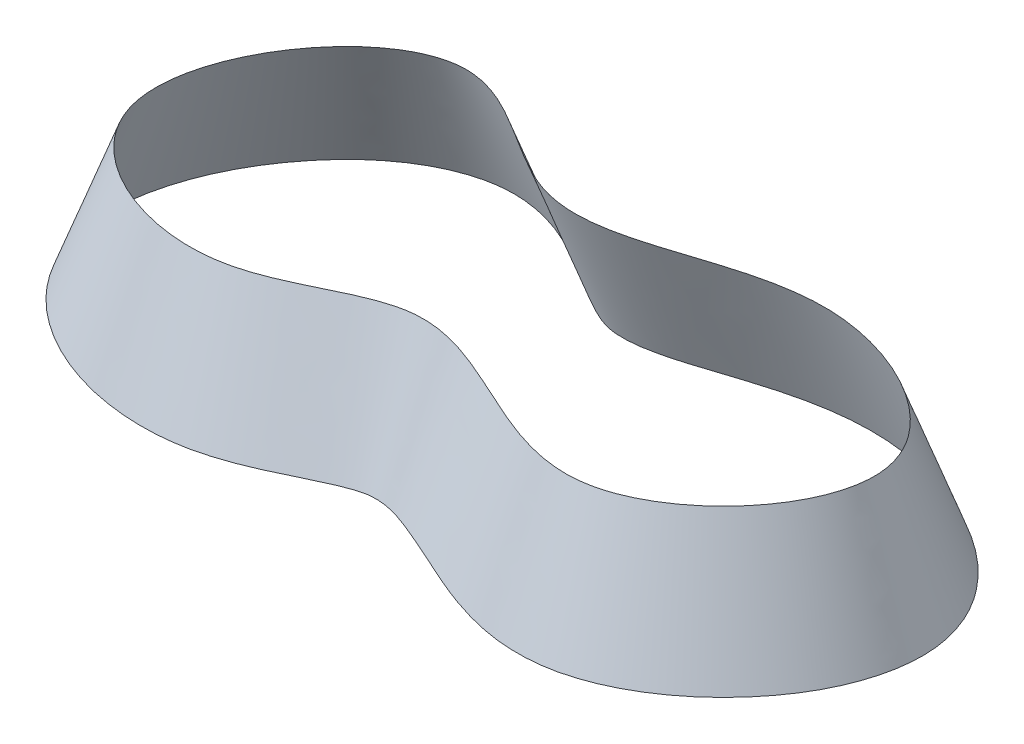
SolidWorks part; units mm, degrees
ref_plane "Front XY" through (0, 0, 0) normal (0, 0, 1) x (1, 0, 0)
ref_plane "Top XZ" through (0, 0, 0) normal (0, 1, 0) x (1, 0, 0)
ref_plane "Right YZ" through (0, 0, 0) normal (1, 0, 0) x (0, 0, -1)
sketch "Sketch1" plane through (0, 0, 0) normal (0, 1, 0) x (1, 0, 0)
  spline S0 degree 3 poles (39.677, -36.9078) (4.017, -0.3298) (-26.5781, -27.4979) (-74.8669, -7.0946) (-37.7696, 46.4378) (-3.0666, 8.7856) (31.545, 37.6168) (81.1209, 9.9494) (39.677, -36.9078) (4.017, -0.3298) (-26.5781, -27.4979) knots -0.392306 -0.273603 -0.1444 0 0.092111 0.21453 0.359628 0.455139 0.607694 0.726397 0.8556 1 1.092111 1.21453 1.359628 only from (0, -10.5909) to (0, -10.5909)
surface "Surface-Plane1" sketch "Sketch1"
other "Ruled Surface1" parameters "D1"=25.4, "D2"=20
sketch3d "3DSketch1"
  spline S0 degree 1 poles (-54.9928, 1879.3755, -671.2317) (55.6909, -1903.2331, 701.0689) knots -78.739749 -78.739749 79.739308 79.739308 only from (0, 0, 10.5909) to (0.6984, -23.8682, 19.2501) construction
  spline S1 degree 1 poles (0, 0, 10.5909) (0.6984, -23.8682, 19.2501) knots 0 0 1 1
sketch3d "3DSketch2"
  spline S0 degree 1 poles (125.1056, 1879.9208, -661.0015) (-115.7, -1903.7816, 691.4528) knots -78.762595 -78.762595 79.762286 79.762286 only from (5.4621, 0, 10.9612) to (3.943, -23.8682, 19.4927) construction
  spline S1 degree 1 poles (5.4621, 0, 10.9612) (3.943, -23.8682, 19.4927) knots 0 0 1 1
sketch3d "3DSketch3"
  spline S0 degree 1 poles (252.5689, 1879.1403, -628.0759) (-233.5531, -1903.0009, 661.4129) knots -78.729896 -78.729896 79.729578 79.729578 only from (11.0413, 0, 12.601) to (7.9735, -23.8682, 20.7386) construction
  spline S1 degree 1 poles (11.0413, 0, 12.601) (7.9735, -23.8682, 20.7386) knots 0 0 1 1
sketch3d "3DSketch4"
  spline S0 degree 1 poles (302.5055, 1878.9179, -607.8788) (-272.6737, -1902.7763, 645.7811) knots -78.720576 -78.720576 79.720166 79.720166 only from (16.7303, 0, 14.9965) to (13.1, -23.8682, 22.909) construction
  spline S1 degree 1 poles (16.7303, 0, 14.9965) (13.1, -23.8682, 22.909) knots 0 0 1 1
sketch3d "3DSketch5"
  spline S0 degree 1 poles (298.5985, 1879.4447, -608.0049) (-257.0595, -1903.3015, 651.2153) knots -78.74265 -78.74265 79.742172 79.742172 only from (22.5217, 0, 17.6344) to (19.0156, -23.8682, 25.5798) construction
  spline S1 degree 1 poles (22.5217, 0, 17.6344) (19.0156, -23.8682, 25.5798) knots 0 0 1 1
sketch3d "3DSketch6"
  spline S0 degree 1 poles (252.1261, 1879.3837, -626.3932) (-198.1498, -1903.2412, 674.6006) knots -78.740092 -78.740092 79.739647 79.739647 only from (28.4081, 0, 20.0009) to (25.5669, -23.8682, 28.2101) construction
  spline S1 degree 1 poles (28.4081, 0, 20.0009) (25.5669, -23.8682, 28.2101) knots 0 0 1 1
sketch3d "3DSketch7"
  spline S0 degree 1 poles (149.2336, 1879.2645, -653.057) (-81.9272, -1903.1235, 704.7873) knots -78.735097 -78.735097 79.734714 79.734714 only from (34.3823, 0, 21.5826) to (32.9235, -23.8682, 30.151) construction
  spline S1 degree 1 poles (34.3823, 0, 21.5826) (32.9235, -23.8682, 30.151) knots 0 0 1 1
sketch3d "3DSketch8"
  spline S0 degree 1 poles (-22.0093, 1879.5172, -658.9259) (103.6755, -1903.3781, 711.3001) knots -78.745688 -78.745688 79.745381 79.745381 only from (40.4367, 0, 21.8657) to (41.2297, -23.8682, 30.5112) construction
  spline S1 degree 1 poles (40.4367, 0, 21.8657) (41.2297, -23.8682, 30.5112) knots 0 0 1 1
sketch3d "3DSketch9"
  spline S0 degree 1 poles (-195.0888, 1879.2997, -619.7593) (291.2296, -1903.1583, 668.7005) knots -78.736573 -78.736573 79.736172 79.736172 only from (46.5366, 0, 20.4069) to (49.6054, -23.8682, 28.5374) construction
  spline S1 degree 1 poles (46.5366, 0, 20.4069) (49.6054, -23.8682, 28.5374) knots 0 0 1 1
sketch3d "3DSketch10"
  spline S0 degree 1 poles (-327.7998, 1879.3448, -551.41) (437.4878, -1903.2028, 593.2619) knots -78.738462 -78.738462 79.738036 79.738036 only from (52.4305, 0, 17.316) to (57.2595, -23.8682, 24.539) construction
  spline S1 degree 1 poles (52.4305, 0, 17.316) (57.2595, -23.8682, 24.539) knots 0 0 1 1
sketch3d "3DSketch11"
  spline S0 degree 1 poles (-422.8613, 1879.3579, -473.8347) (544.4908, -1903.2158, 505.944) knots -78.739011 -78.739011 79.738579 79.738579 only from (57.764, 0, 12.9647) to (63.8681, -23.8682, 19.1472) construction
  spline S1 degree 1 poles (57.764, 0, 12.9647) (63.8681, -23.8682, 19.1472) knots 0 0 1 1
sketch3d "3DSketch12"
  spline S0 degree 1 poles (-500.2545, 1879.0813, -383.0317) (631.7613, -1902.9427, 403.4469) knots -78.727424 -78.727424 79.727137 79.727137 only from (62.1823, 0, 7.7266) to (69.3264, -23.8682, 12.69) construction
  spline S1 degree 1 poles (62.1823, 0, 7.7266) (69.3264, -23.8682, 12.69) knots 0 0 1 1
sketch3d "3DSketch13"
  spline S0 degree 1 poles (-568.1714, 1879.33, -256.396) (706.8749, -1903.1882, 263.6261) knots -78.737844 -78.737844 79.737426 79.737426 only from (65.3306, 0, 1.975) to (73.3763, -23.8682, 5.2564) construction
  spline S1 degree 1 poles (65.3306, 0, 1.975) (73.3763, -23.8682, 5.2564) knots 0 0 1 1
sketch3d "3DSketch14"
  spline S0 degree 1 poles (-614.2599, 1879.4066, -66.1455) (756.6136, -1903.2639, 59.1024) knots -78.741054 -78.741054 79.740596 79.740596 only from (66.8538, 0, -3.9165) to (75.5038, -23.8682, -3.1262) construction
  spline S1 degree 1 poles (66.8538, 0, -3.9165) (75.5038, -23.8682, -3.1262) knots 0 0 1 1
sketch3d "3DSketch15"
  spline S0 degree 1 poles (-592.2725, 1879.5635, 173.0423) (733.4369, -1903.4238, -194.5123) knots -78.747628 -78.747628 79.747296 79.747296 only from (66.4014, 0, -9.5759) to (74.7658, -23.8682, -11.8949) construction
  spline S1 degree 1 poles (66.4014, 0, -9.5759) (74.7658, -23.8682, -11.8949) knots 0 0 1 1
sketch3d "3DSketch16"
  spline S0 degree 1 poles (-495.1514, 1879.3304, 379.6662) (630.0528, -1903.1886, -414.105) knots -78.737861 -78.737861 79.737443 79.737443 only from (63.9021, 0, -14.716) to (71.0023, -23.8682, -19.7248) construction
  spline S1 degree 1 poles (63.9021, 0, -14.716) (71.0023, -23.8682, -19.7248) knots 0 0 1 1
sketch3d "3DSketch17"
  spline S0 degree 1 poles (-380.7474, 1879.3652, 504.1891) (505.806, -1903.223, -549.206) knots -78.73932 -78.73932 79.738884 79.738884 only from (59.7334, 0, -19.1864) to (65.3276, -23.8682, -25.8334) construction
  spline S1 degree 1 poles (59.7334, 0, -19.1864) (65.3276, -23.8682, -25.8334) knots 0 0 1 1
sketch3d "3DSketch18"
  spline S0 degree 1 poles (-272.9752, 1879.2591, 578.1767) (385.7574, -1903.1183, -631.5057) knots -78.734874 -78.734874 79.734494 79.734494 only from (54.3135, 0, -22.8492) to (58.4703, -23.8682, -30.4827) construction
  spline S1 degree 1 poles (54.3135, 0, -22.8492) (58.4703, -23.8682, -30.4827) knots 0 0 1 1
sketch3d "3DSketch19"
  spline S0 degree 1 poles (-170.6799, 1879.3071, 622.7548) (269.5778, -1903.1656, -682.1178) knots -78.736882 -78.736882 79.736477 79.736477 only from (48.0604, 0, -25.5662) to (50.8386, -23.8682, -33.8002) construction
  spline S1 degree 1 poles (48.0604, 0, -25.5662) (50.8386, -23.8682, -33.8002) knots 0 0 1 1
sketch3d "3DSketch20"
  spline S0 degree 1 poles (-58.9708, 1879.6131, 648.7727) (143.0295, -1903.4728, -711.7523) knots -78.749705 -78.749705 79.749347 79.749347 only from (41.3924, 0, -27.1994) to (42.6668, -23.8682, -35.7832) construction
  spline S1 degree 1 poles (41.3924, 0, -27.1994) (42.6668, -23.8682, -35.7832) knots 0 0 1 1
sketch3d "3DSketch21"
  spline S0 degree 1 poles (50.0072, 1879.2149, 656.6983) (19.2451, -1903.0746, -720.6184) knots -78.73302 -78.73302 79.732663 79.732663 only from (34.7232, 0, -27.6158) to (34.5291, -23.8682, -36.3074) construction
  spline S1 degree 1 poles (34.7232, 0, -27.6158) (34.5291, -23.8682, -36.3074) knots 0 0 1 1
sketch3d "3DSketch22"
  spline S0 degree 1 poles (139.3147, 1878.8994, 649.4038) (-84.1506, -1902.7581, -711.7856) knots -78.719803 -78.719803 79.719403 79.719403 only from (28.287, 0, -26.897) to (26.8765, -23.8682, -35.4883) construction
  spline S1 degree 1 poles (28.287, 0, -26.897) (26.8765, -23.8682, -35.4883) knots 0 0 1 1
sketch3d "3DSketch23"
  spline S0 degree 1 poles (200.0751, 1878.8281, 636.6256) (-158.1864, -1902.6877, -695.8628) knots -78.716816 -78.716816 79.716454 79.716454 only from (22.0746, 0, -25.4149) to (19.8133, -23.8682, -33.8254) construction
  spline S1 degree 1 poles (22.0746, 0, -25.4149) (19.8133, -23.8682, -33.8254) knots 0 0 1 1
sketch3d "3DSketch24"
  spline S0 degree 1 poles (223.9893, 1879.2042, 628.6068) (-194.5102, -1903.064, -684.0114) knots -78.732574 -78.732574 79.732222 79.732222 only from (16.0596, 0, -23.5621) to (13.4186, -23.8682, -31.8454) construction
  spline S1 degree 1 poles (16.0596, 0, -23.5621) (13.4186, -23.8682, -31.8454) knots 0 0 1 1
sketch3d "3DSketch25"
  spline S0 degree 1 poles (202.899, 1879.3907, 634.5628) (-184.9137, -1903.2481, -686.3558) knots -78.740384 -78.740384 79.739935 79.739935 only from (10.2156, 0, -21.7309) to (7.7686, -23.8682, -30.0658) construction
  spline S1 degree 1 poles (10.2156, 0, -21.7309) (7.7686, -23.8682, -30.0658) knots 0 0 1 1
sketch3d "3DSketch26"
  spline S0 degree 1 poles (132.8559, 1879.4017, 651.5007) (-125.4523, -1903.259, -700.6566) knots -78.740848 -78.740848 79.740392 79.740392 only from (4.5163, 0, -20.3139) to (2.8864, -23.8682, -28.8459) construction
  spline S1 degree 1 poles (4.5163, 0, -20.3139) (2.8864, -23.8682, -28.8459) knots 0 0 1 1
sketch3d "3DSketch27"
  spline S0 degree 1 poles (9.1811, 1879.2284, 664.6664) (-11.4406, -1903.0879, -712.7626) knots -78.733587 -78.733587 79.733223 79.733223 only from (-1.0647, 0, -19.7036) to (-1.1948, -23.8682, -28.3958) construction
  spline S1 degree 1 poles (-1.0647, 0, -19.7036) (-1.1948, -23.8682, -28.3958) knots 0 0 1 1
sketch3d "3DSketch28"
  spline S0 degree 1 poles (-170.6524, 1879.5844, 643.1774) (159.6276, -1903.4445, -692.1845) knots -78.748503 -78.748503 79.748161 79.748161 only from (-6.5539, 0, -20.2924) to (-4.4701, -23.8682, -28.7176) construction
  spline S1 degree 1 poles (-6.5539, 0, -20.2924) (-4.4701, -23.8682, -28.7176) knots 0 0 1 1
sketch3d "3DSketch29"
  spline S0 degree 1 poles (-318.8223, 1879.2825, 589.2619) (298.7604, -1903.1413, -641.7917) knots -78.735852 -78.735852 79.73546 79.73546 only from (-11.9787, 0, -22.3823) to (-8.0816, -23.8682, -30.1506) construction
  spline S1 degree 1 poles (-11.9787, 0, -22.3823) (-8.0816, -23.8682, -30.1506) knots 0 0 1 1
sketch3d "3DSketch30"
  spline S0 degree 1 poles (-379.8106, 1879.3202, 554.8044) (349.6599, -1903.1785, -613.18) knots -78.737432 -78.737432 79.737019 79.737019 only from (-17.3759, 0, -25.5042) to (-12.7729, -23.8682, -32.8744) construction
  spline S1 degree 1 poles (-17.3759, 0, -25.5042) (-12.7729, -23.8682, -32.8744) knots 0 0 1 1
sketch3d "3DSketch31"
  spline S0 degree 1 poles (-361.047, 1879.3177, 565.9331) (319.7675, -1903.1761, -631.0834) knots -78.737329 -78.737329 79.736918 79.736918 only from (-22.7869, 0, -28.8) to (-18.4909, -23.8682, -36.3534) construction
  spline S1 degree 1 poles (-22.7869, 0, -28.8) (-18.4909, -23.8682, -36.3534) knots 0 0 1 1
sketch3d "3DSketch32"
  spline S0 degree 1 poles (-259.8358, 1879.3177, 612.4007) (206.2696, -1903.1761, -683.3906) knots -78.737329 -78.737329 79.736918 79.736918 only from (-28.2531, 0, -31.4083) to (-25.3119, -23.8682, -39.585) construction
  spline S1 degree 1 poles (-28.2531, 0, -31.4083) (-25.3119, -23.8682, -39.585) knots 0 0 1 1
sketch3d "3DSketch33"
  spline S0 degree 1 poles (-33.1173, 1879.3898, 651.5292) (-34.5234, -1903.2473, -725.1477) knots -78.74035 -78.74035 79.739901 79.739901 only from (-33.8159, 0, -32.4678) to (-33.8248, -23.8682, -41.1545) construction
  spline S1 degree 1 poles (-33.8159, 0, -32.4678) (-33.8248, -23.8682, -41.1545) knots 0 0 1 1
sketch3d "3DSketch34"
  spline S0 degree 1 poles (202.4401, 1879.5222, 608.0837) (-284.4336, -1903.383, -678.8475) knots -78.745894 -78.745894 79.745585 79.745585 only from (-39.4613, 0, -31.3232) to (-42.5332, -23.8682, -39.4431) construction
  spline S1 degree 1 poles (-39.4613, 0, -31.3232) (-42.5332, -23.8682, -39.4431) knots 0 0 1 1
sketch3d "3DSketch35"
  spline S0 degree 1 poles (366.921, 1879.2907, 518.2532) (-462.0292, -1903.1494, -581.5722) knots -78.736196 -78.736196 79.735799 79.735799 only from (-44.9397, 0, -28.1908) to (-50.1706, -23.8682, -35.131) construction
  spline S1 degree 1 poles (-44.9397, 0, -28.1908) (-50.1706, -23.8682, -35.131) knots 0 0 1 1
sketch3d "3DSketch36"
  spline S0 degree 1 poles (463.4248, 1879.455, 428.213) (-569.8206, -1903.3116, -480.9813) knots -78.743079 -78.743079 79.742596 79.742596 only from (-49.9397, 0, -23.5172) to (-56.4592, -23.8682, -29.2539) construction
  spline S1 degree 1 poles (-49.9397, 0, -23.5172) (-56.4592, -23.8682, -29.2539) knots 0 0 1 1
sketch3d "3DSketch37"
  spline S0 degree 1 poles (532.255, 1879.142, 335.6994) (-648.0004, -1903.0025, -375.6853) knots -78.729965 -78.729965 79.729646 79.729646 only from (-54.1497, 0, -17.7489) to (-61.598, -23.8682, -22.2383) construction
  spline S1 degree 1 poles (-54.1497, 0, -17.7489) (-61.598, -23.8682, -22.2383) knots 0 0 1 1
sketch3d "3DSketch38"
  spline S0 degree 1 poles (583.9685, 1879.0592, 229.3551) (-706.626, -1902.9158, -255.0762) knots -78.726498 -78.726498 79.726013 79.726013 only from (-57.2582, 0, -11.3327) to (-65.4032, -23.8682, -14.3899) construction
  spline S1 degree 1 poles (-57.2582, 0, -11.3327) (-65.4032, -23.8682, -14.3899) knots 0 0 1 1
sketch3d "3DSketch39"
  spline S0 degree 1 poles (619.4559, 1879.4189, 81.8948) (-745.9748, -1903.276, -92.4242) knots -78.741569 -78.741569 79.741104 79.741104 only from (-58.9536, 0, -4.715) to (-67.5693, -23.8682, -5.8149) construction
  spline S1 degree 1 poles (-58.9536, 0, -4.715) (-67.5693, -23.8682, -5.8149) knots 0 0 1 1
sketch3d "3DSketch40"
  spline S0 degree 1 poles (615.9086, 1879.2309, -112.6174) (-742.3254, -1903.0903, 117.3833) knots -78.73369 -78.73369 79.733324 79.733324 only from (-58.9244, 0, 1.6575) to (-67.4955, -23.8682, 3.1089) construction
  spline S1 degree 1 poles (-58.9244, 0, 1.6575) (-67.4955, -23.8682, 3.1089) knots 0 0 1 1
sketch3d "3DSketch41"
  spline S0 degree 1 poles (538.2079, 1879.4021, -329.7508) (-659.5759, -1903.2594, 348.7497) knots -78.740865 -78.740865 79.740409 79.740409 only from (-56.9068, 0, 7.3598) to (-64.4647, -23.8682, 11.641) construction
  spline S1 degree 1 poles (-56.9068, 0, 7.3598) (-64.4647, -23.8682, 11.641) knots 0 0 1 1
sketch3d "3DSketch42"
  spline S0 degree 1 poles (417.0084, 1879.3984, -484.6491) (-529.1502, -1903.2558, 515.2959) knots -78.74071 -78.74071 79.740257 79.740257 only from (-53.0872, 0, 12.17) to (-59.0574, -23.8682, 18.4796) construction
  spline S1 degree 1 poles (-53.0872, 0, 12.17) (-59.0574, -23.8682, 18.4796) knots 0 0 1 1
sketch3d "3DSketch43"
  spline S0 degree 1 poles (291.369, 1879.4165, -577.8639) (-391.4742, -1903.2736, 617.3582) knots -78.741466 -78.741466 79.741003 79.741003 only from (-47.8993, 0, 15.9781) to (-52.2079, -23.8682, 23.5197) construction
  spline S1 degree 1 poles (-47.8993, 0, 15.9781) (-52.2079, -23.8682, 23.5197) knots 0 0 1 1
sketch3d "3DSketch44"
  spline S0 degree 1 poles (171.7099, 1879.142, -631.8782) (-257.9793, -1903.0025, 677.4882) knots -78.729965 -78.729965 79.729646 79.729646 only from (-41.7793, 0, 18.6748) to (-44.491, -23.8682, 26.9379) construction
  spline S1 degree 1 poles (-41.7793, 0, 18.6748) (-44.491, -23.8682, 26.9379) knots 0 0 1 1
sketch3d "3DSketch45"
  spline S0 degree 1 poles (47.8977, 1879.4394, -658.6447) (-119.2789, -1903.2963, 707.5633) knots -78.742427 -78.742427 79.741952 79.741952 only from (-35.1634, 0, 20.1512) to (-36.2183, -23.8682, 28.7716) construction
  spline S1 degree 1 poles (-35.1634, 0, 20.1512) (-36.2183, -23.8682, 28.7716) knots 0 0 1 1
sketch3d "3DSketch46"
  spline S0 degree 1 poles (-90.6204, 1879.439, -660.7336) (34.4335, -1903.2959, 709.9746) knots -78.74241 -78.74241 79.741935 79.741935 only from (-28.4878, 0, 20.2981) to (-27.6987, -23.8682, 28.947) construction
  spline S1 degree 1 poles (-28.4878, 0, 20.2981) (-27.6987, -23.8682, 28.947) knots 0 0 1 1
sketch3d "3DSketch47"
  spline S0 degree 1 poles (-222.7024, 1879.5025, -634.5832) (180.9139, -1903.3635, 680.9549) knots -78.74507 -78.74507 79.744771 79.744771 only from (-22.1672, 0, 19.0369) to (-19.6205, -23.8682, 27.3373) construction
  spline S1 degree 1 poles (-22.1672, 0, 19.0369) (-19.6205, -23.8682, 27.3373) knots 0 0 1 1
sketch3d "3DSketch48"
  spline S0 degree 1 poles (-301.0166, 1879.3083, -605.4411) (272.0299, -1903.1668, 646.8033) knots -78.736934 -78.736934 79.736528 79.736528 only from (-16.3006, 0, 16.7317) to (-12.6846, -23.8682, 24.6337) construction
  spline S1 degree 1 poles (-16.3006, 0, 16.7317) (-12.6846, -23.8682, 24.6337) knots 0 0 1 1
sketch3d "3DSketch49"
  spline S0 degree 1 poles (-305.0816, 1879.2178, -603.8776) (287.3226, -1903.0774, 639.8899) knots -78.73314 -78.73314 79.732782 79.732782 only from (-10.748, 0, 14.0832) to (-7.0096, -23.8682, 21.932) construction
  spline S1 degree 1 poles (-10.748, 0, 14.0832) (-7.0096, -23.8682, 21.932) knots 0 0 1 1
sketch3d "3DSketch50"
  spline S0 degree 1 poles (-228.3731, 1879.5304, -634.4152) (220.4779, -1903.3911, 666.2188) knots -78.746237 -78.746237 79.745924 79.745924 only from (-5.3632, 0, 11.7999) to (-2.5312, -23.8682, 20.0062) construction
  spline S1 degree 1 poles (-5.3632, 0, 11.7999) (-2.5312, -23.8682, 20.0062) knots 0 0 1 1
sketch3d "3DSketch51"
  spline S0 degree 3 poles (0, 0, 10.5909) (3.2496, 0, 10.3288) (9.8841, 0, 11.741) (20.1981, 0, 16.6481) (29.059, 0, 20.5446) (36.2855, 0, 22.036) (43.2121, 0, 21.9452) (51.7054, 0, 18.4974) (60.3543, 0, 11.0071) (66.1995, 0, 1.642) (67.4672, 0, -6.2828) (65.7523, 0, -11.8721) (62.7077, 0, -16.7918) (56.6991, 0, -21.9889) (47.3304, 0, -26.2502) (31.8498, 0, -29.0461) (19.017, 0, -24.4107) (7.9988, 0, -21.0329) (2.612, 0, -19.857) (-2.6754, 0, -19.5345) (-8.3242, 0, -20.4786) (-14.3403, 0, -23.5133) (-20.7757, 0, -27.7054) (-26.1859, 0, -30.7599) (-30.5778, 0, -32.2072) (-36.178, 0, -32.8861) (-42.5405, 0, -30.401) (-48.7963, 0, -25.0257) (-54.275, 0, -18.3224) (-59.0854, 0, -8.2858) (-59.6122, 0, 1.4265) (-56.9643, 0, 7.6504) (-53.1456, 0, 12.6463) (-46.2443, 0, 17.4556) (-36.1214, 0, 20.5393) (-26.5783, 0, 20.5443) (-18.8333, 0, 18.0108) (-12.358, 0, 14.8457) (-6.1637, 0, 11.8804) (-2.0729, 0, 10.7581) (0, 0, 10.5909) (3.2496, 0, 10.3288) (9.8841, 0, 11.741) knots -0.023028 0 0 0 0.0361 0.0722 0.1083 0.12635 0.1444 0.1767 0.209001 0.241302 0.273603 0.288441 0.303279 0.332954 0.36263 0.392306 0.468584 0.487653 0.506722 0.525792 0.544861 0.568739 0.592617 0.616494 0.628433 0.640372 0.676647 0.694784 0.712921 0.749196 0.78547 0.800773 0.816075 0.84668 0.877284 0.907889 0.930917 0.953944 0.976972 1 1 1 1.0361 1.0722 1.1083 only from (0, 0, 10.5909) to (0, 0, 10.5909) construction
  spline S1 degree 3 poles (0, 0, 10.5909) (3.2496, 0, 10.3288) (9.8841, 0, 11.741) (20.1981, 0, 16.6481) (29.059, 0, 20.5446) (36.2855, 0, 22.036) (43.2121, 0, 21.9452) (51.7054, 0, 18.4974) (60.3543, 0, 11.0071) (66.1995, 0, 1.642) (67.4672, 0, -6.2828) (65.7523, 0, -11.8721) (62.7077, 0, -16.7918) (56.6991, 0, -21.9889) (47.3304, 0, -26.2502) (31.8498, 0, -29.0461) (19.017, 0, -24.4107) (7.9988, 0, -21.0329) (2.612, 0, -19.857) (-2.6754, 0, -19.5345) (-8.3242, 0, -20.4786) (-14.3403, 0, -23.5133) (-20.7757, 0, -27.7054) (-26.1859, 0, -30.7599) (-30.5778, 0, -32.2072) (-36.178, 0, -32.8861) (-42.5405, 0, -30.401) (-48.7963, 0, -25.0257) (-54.275, 0, -18.3224) (-59.0854, 0, -8.2858) (-59.6122, 0, 1.4265) (-56.9643, 0, 7.6504) (-53.1456, 0, 12.6463) (-46.2443, 0, 17.4556) (-36.1214, 0, 20.5393) (-26.5783, 0, 20.5443) (-18.8333, 0, 18.0108) (-12.358, 0, 14.8457) (-6.1637, 0, 11.8804) (-2.0729, 0, 10.7581) (0, 0, 10.5909) (3.2496, 0, 10.3288) (9.8841, 0, 11.741) knots -0.023028 0 0 0 0.0361 0.0722 0.1083 0.12635 0.1444 0.1767 0.209001 0.241302 0.273603 0.288441 0.303279 0.332954 0.36263 0.392306 0.468584 0.487653 0.506722 0.525792 0.544861 0.568739 0.592617 0.616494 0.628433 0.640372 0.676647 0.694784 0.712921 0.749196 0.78547 0.800773 0.816075 0.84668 0.877284 0.907889 0.930917 0.953944 0.976972 1 1 1 1.0361 1.0722 1.1083 only from (0, 0, 10.5909) to (0, 0, 10.5909)
sketch3d "3DSketch52"
  spline S0 degree 3 poles (0.2328, -7.9561, 13.4773) (3.0103, -7.9561, 13.2555) (8.7278, -7.9561, 14.4395) (18.9134, -7.9561, 19.2296) (28.0675, -7.9561, 23.2878) (35.9603, -7.9561, 24.9407) (43.8859, -7.9561, 24.8347) (53.3133, -7.9561, 20.9696) (62.5633, -7.9561, 12.9247) (68.9295, -7.9561, 2.8277) (70.4733, -7.9561, -6.3728) (68.4057, -7.9561, -13.1193) (64.8721, -7.9561, -18.786) (58.2275, -7.9561, -24.4879) (48.2202, -7.9561, -29.0402) (31.5203, -7.9561, -32.0433) (17.9664, -7.9561, -27.1087) (7.2311, -7.9561, -23.8292) (2.1738, -7.9561, -22.7281) (-2.5702, -7.9561, -22.4597) (-7.3315, -7.9561, -23.2454) (-12.7975, -7.9561, -25.9688) (-19.207, -7.9561, -30.138) (-24.919, -7.9561, -33.3832) (-29.8962, -7.9561, -35.0448) (-36.7034, -7.9561, -35.8699) (-44.1078, -7.9561, -32.8961) (-50.8888, -7.9561, -27.0465) (-56.7687, -7.9561, -19.8451) (-61.9203, -7.9561, -9.1627) (-62.598, -7.9561, 1.8059) (-59.4807, -7.9561, 9.1521) (-55.1075, -7.9561, 14.8417) (-47.4837, -7.9561, 20.1187) (-36.5906, -7.9561, 23.4416) (-26.1305, -7.9561, 23.4525) (-17.6608, -7.9561, 20.6726) (-11.046, -7.9561, 17.4193) (-5.0162, -7.9561, 14.5641) (-1.5389, -7.9561, 13.6188) (0.2328, -7.9561, 13.4773) (3.0103, -7.9561, 13.2555) (8.7278, -7.9561, 14.4395) knots -0.023028 0 0 0 0.0361 0.0722 0.1083 0.12635 0.1444 0.1767 0.209001 0.241302 0.273603 0.288441 0.303279 0.332954 0.36263 0.392306 0.468584 0.487653 0.506722 0.525792 0.544861 0.568739 0.592617 0.616494 0.628433 0.640372 0.676647 0.694784 0.712921 0.749196 0.78547 0.800773 0.816075 0.84668 0.877284 0.907889 0.930917 0.953944 0.976972 1 1 1 1.0361 1.0722 1.1083 only from (0.2328, -7.9561, 13.4773) to (0.2328, -7.9561, 13.4773) construction
  spline S1 degree 3 poles (0.2328, -7.9561, 13.4773) (3.0103, -7.9561, 13.2555) (8.7278, -7.9561, 14.4395) (18.9134, -7.9561, 19.2296) (28.0675, -7.9561, 23.2878) (35.9603, -7.9561, 24.9407) (43.8859, -7.9561, 24.8347) (53.3133, -7.9561, 20.9696) (62.5633, -7.9561, 12.9247) (68.9295, -7.9561, 2.8277) (70.4733, -7.9561, -6.3728) (68.4057, -7.9561, -13.1193) (64.8721, -7.9561, -18.786) (58.2275, -7.9561, -24.4879) (48.2202, -7.9561, -29.0402) (31.5203, -7.9561, -32.0433) (17.9664, -7.9561, -27.1087) (7.2311, -7.9561, -23.8292) (2.1738, -7.9561, -22.7281) (-2.5702, -7.9561, -22.4597) (-7.3315, -7.9561, -23.2454) (-12.7975, -7.9561, -25.9688) (-19.207, -7.9561, -30.138) (-24.919, -7.9561, -33.3832) (-29.8962, -7.9561, -35.0448) (-36.7034, -7.9561, -35.8699) (-44.1078, -7.9561, -32.8961) (-50.8888, -7.9561, -27.0465) (-56.7687, -7.9561, -19.8451) (-61.9203, -7.9561, -9.1627) (-62.598, -7.9561, 1.8059) (-59.4807, -7.9561, 9.1521) (-55.1075, -7.9561, 14.8417) (-47.4837, -7.9561, 20.1187) (-36.5906, -7.9561, 23.4416) (-26.1305, -7.9561, 23.4525) (-17.6608, -7.9561, 20.6726) (-11.046, -7.9561, 17.4193) (-5.0162, -7.9561, 14.5641) (-1.5389, -7.9561, 13.6188) (0.2328, -7.9561, 13.4773) (3.0103, -7.9561, 13.2555) (8.7278, -7.9561, 14.4395) knots -0.023028 0 0 0 0.0361 0.0722 0.1083 0.12635 0.1444 0.1767 0.209001 0.241302 0.273603 0.288441 0.303279 0.332954 0.36263 0.392306 0.468584 0.487653 0.506722 0.525792 0.544861 0.568739 0.592617 0.616494 0.628433 0.640372 0.676647 0.694784 0.712921 0.749196 0.78547 0.800773 0.816075 0.84668 0.877284 0.907889 0.930917 0.953944 0.976972 1 1 1 1.0361 1.0722 1.1083 only from (0.2328, -7.9561, 13.4773) to (0.2328, -7.9561, 13.4773)
sketch3d "3DSketch53"
  spline S0 degree 3 poles (0.4656, -15.9121, 16.3637) (2.7709, -15.9121, 16.1822) (7.5715, -15.9121, 17.138) (17.6287, -15.9121, 21.811) (27.0759, -15.9121, 26.0309) (35.6351, -15.9121, 27.8454) (44.5597, -15.9121, 27.7243) (54.9212, -15.9121, 23.4419) (64.7723, -15.9121, 14.8422) (71.6596, -15.9121, 4.0135) (73.4794, -15.9121, -6.4629) (71.0591, -15.9121, -14.3665) (67.0366, -15.9121, -20.7801) (59.7558, -15.9121, -26.9869) (49.1101, -15.9121, -31.8303) (31.1908, -15.9121, -35.0405) (16.9157, -15.9121, -29.8066) (6.4634, -15.9121, -26.6255) (1.7355, -15.9121, -25.5992) (-2.465, -15.9121, -25.3849) (-6.3389, -15.9121, -26.0121) (-11.2547, -15.9121, -28.4243) (-17.6383, -15.9121, -32.5706) (-23.652, -15.9121, -36.0065) (-29.2146, -15.9121, -37.8823) (-37.2288, -15.9121, -38.8536) (-45.6752, -15.9121, -35.3911) (-52.9813, -15.9121, -29.0673) (-59.2623, -15.9121, -21.3678) (-64.7553, -15.9121, -10.0396) (-65.5838, -15.9121, 2.1852) (-61.9971, -15.9121, 10.6537) (-57.0695, -15.9121, 17.0372) (-48.723, -15.9121, 22.7819) (-37.0598, -15.9121, 26.344) (-25.6828, -15.9121, 26.3607) (-16.4884, -15.9121, 23.3343) (-9.7341, -15.9121, 19.993) (-3.8686, -15.9121, 17.2478) (-1.0049, -15.9121, 16.4795) (0.4656, -15.9121, 16.3637) (2.7709, -15.9121, 16.1822) (7.5715, -15.9121, 17.138) knots -0.023028 0 0 0 0.0361 0.0722 0.1083 0.12635 0.1444 0.1767 0.209001 0.241302 0.273603 0.288441 0.303279 0.332954 0.36263 0.392306 0.468584 0.487653 0.506722 0.525792 0.544861 0.568739 0.592617 0.616494 0.628433 0.640372 0.676647 0.694784 0.712921 0.749196 0.78547 0.800773 0.816075 0.84668 0.877284 0.907889 0.930917 0.953944 0.976972 1 1 1 1.0361 1.0722 1.1083 only from (0.4656, -15.9121, 16.3637) to (0.4656, -15.9121, 16.3637) construction
  spline S1 degree 3 poles (0.4656, -15.9121, 16.3637) (2.7709, -15.9121, 16.1822) (7.5715, -15.9121, 17.138) (17.6287, -15.9121, 21.811) (27.0759, -15.9121, 26.0309) (35.6351, -15.9121, 27.8454) (44.5597, -15.9121, 27.7243) (54.9212, -15.9121, 23.4419) (64.7723, -15.9121, 14.8422) (71.6596, -15.9121, 4.0135) (73.4794, -15.9121, -6.4629) (71.0591, -15.9121, -14.3665) (67.0366, -15.9121, -20.7801) (59.7558, -15.9121, -26.9869) (49.1101, -15.9121, -31.8303) (31.1908, -15.9121, -35.0405) (16.9157, -15.9121, -29.8066) (6.4634, -15.9121, -26.6255) (1.7355, -15.9121, -25.5992) (-2.465, -15.9121, -25.3849) (-6.3389, -15.9121, -26.0121) (-11.2547, -15.9121, -28.4243) (-17.6383, -15.9121, -32.5706) (-23.652, -15.9121, -36.0065) (-29.2146, -15.9121, -37.8823) (-37.2288, -15.9121, -38.8536) (-45.6752, -15.9121, -35.3911) (-52.9813, -15.9121, -29.0673) (-59.2623, -15.9121, -21.3678) (-64.7553, -15.9121, -10.0396) (-65.5838, -15.9121, 2.1852) (-61.9971, -15.9121, 10.6537) (-57.0695, -15.9121, 17.0372) (-48.723, -15.9121, 22.7819) (-37.0598, -15.9121, 26.344) (-25.6828, -15.9121, 26.3607) (-16.4884, -15.9121, 23.3343) (-9.7341, -15.9121, 19.993) (-3.8686, -15.9121, 17.2478) (-1.0049, -15.9121, 16.4795) (0.4656, -15.9121, 16.3637) (2.7709, -15.9121, 16.1822) (7.5715, -15.9121, 17.138) knots -0.023028 0 0 0 0.0361 0.0722 0.1083 0.12635 0.1444 0.1767 0.209001 0.241302 0.273603 0.288441 0.303279 0.332954 0.36263 0.392306 0.468584 0.487653 0.506722 0.525792 0.544861 0.568739 0.592617 0.616494 0.628433 0.640372 0.676647 0.694784 0.712921 0.749196 0.78547 0.800773 0.816075 0.84668 0.877284 0.907889 0.930917 0.953944 0.976972 1 1 1 1.0361 1.0722 1.1083 only from (0.4656, -15.9121, 16.3637) to (0.4656, -15.9121, 16.3637)
sketch3d "3DSketch54"
  spline S0 degree 3 poles (0.6984, -23.8682, 19.2501) (2.5315, -23.8682, 19.1089) (6.4151, -23.8682, 19.8365) (16.3439, -23.8682, 24.3925) (26.0844, -23.8682, 28.774) (35.3098, -23.8682, 30.7501) (45.2334, -23.8682, 30.6139) (56.5291, -23.8682, 25.9141) (66.9812, -23.8682, 16.7598) (74.3897, -23.8682, 5.1992) (76.4855, -23.8682, -6.5529) (73.7125, -23.8682, -15.6137) (69.201, -23.8682, -22.7742) (61.2841, -23.8682, -29.486) (50, -23.8682, -34.6204) (30.8613, -23.8682, -38.0377) (15.8651, -23.8682, -32.5046) (5.6958, -23.8682, -29.4218) (1.2973, -23.8682, -28.4703) (-2.3599, -23.8682, -28.3101) (-5.3463, -23.8682, -28.7789) (-9.712, -23.8682, -30.8798) (-16.0695, -23.8682, -35.0032) (-22.3851, -23.8682, -38.6298) (-28.533, -23.8682, -40.7199) (-37.7542, -23.8682, -41.8374) (-47.2425, -23.8682, -37.8861) (-55.0738, -23.8682, -31.0881) (-61.7559, -23.8682, -22.8906) (-67.5903, -23.8682, -10.9164) (-68.5697, -23.8682, 2.5646) (-64.5135, -23.8682, 12.1554) (-59.0314, -23.8682, 19.2326) (-49.9623, -23.8682, 25.445) (-37.529, -23.8682, 29.2463) (-25.2351, -23.8682, 29.2689) (-15.3159, -23.8682, 25.9961) (-8.4222, -23.8682, 22.5666) (-2.7211, -23.8682, 19.9315) (-0.4709, -23.8682, 19.3402) (0.6984, -23.8682, 19.2501) (2.5315, -23.8682, 19.1089) (6.4151, -23.8682, 19.8365) knots -0.023028 0 0 0 0.0361 0.0722 0.1083 0.12635 0.1444 0.1767 0.209001 0.241302 0.273603 0.288441 0.303279 0.332954 0.36263 0.392306 0.468584 0.487653 0.506722 0.525792 0.544861 0.568739 0.592617 0.616494 0.628433 0.640372 0.676647 0.694784 0.712921 0.749196 0.78547 0.800773 0.816075 0.84668 0.877284 0.907889 0.930917 0.953944 0.976972 1 1 1 1.0361 1.0722 1.1083 only from (0.6984, -23.8682, 19.2501) to (0.6984, -23.8682, 19.2501) construction
  spline S1 degree 3 poles (0.6984, -23.8682, 19.2501) (2.5315, -23.8682, 19.1089) (6.4151, -23.8682, 19.8365) (16.3439, -23.8682, 24.3925) (26.0844, -23.8682, 28.774) (35.3098, -23.8682, 30.7501) (45.2334, -23.8682, 30.6139) (56.5291, -23.8682, 25.9141) (66.9812, -23.8682, 16.7598) (74.3897, -23.8682, 5.1992) (76.4855, -23.8682, -6.5529) (73.7125, -23.8682, -15.6137) (69.201, -23.8682, -22.7742) (61.2841, -23.8682, -29.486) (50, -23.8682, -34.6204) (30.8613, -23.8682, -38.0377) (15.8651, -23.8682, -32.5046) (5.6958, -23.8682, -29.4218) (1.2973, -23.8682, -28.4703) (-2.3599, -23.8682, -28.3101) (-5.3463, -23.8682, -28.7789) (-9.712, -23.8682, -30.8798) (-16.0695, -23.8682, -35.0032) (-22.3851, -23.8682, -38.6298) (-28.533, -23.8682, -40.7199) (-37.7542, -23.8682, -41.8374) (-47.2425, -23.8682, -37.8861) (-55.0738, -23.8682, -31.0881) (-61.7559, -23.8682, -22.8906) (-67.5903, -23.8682, -10.9164) (-68.5697, -23.8682, 2.5646) (-64.5135, -23.8682, 12.1554) (-59.0314, -23.8682, 19.2326) (-49.9623, -23.8682, 25.445) (-37.529, -23.8682, 29.2463) (-25.2351, -23.8682, 29.2689) (-15.3159, -23.8682, 25.9961) (-8.4222, -23.8682, 22.5666) (-2.7211, -23.8682, 19.9315) (-0.4709, -23.8682, 19.3402) (0.6984, -23.8682, 19.2501) (2.5315, -23.8682, 19.1089) (6.4151, -23.8682, 19.8365) knots -0.023028 0 0 0 0.0361 0.0722 0.1083 0.12635 0.1444 0.1767 0.209001 0.241302 0.273603 0.288441 0.303279 0.332954 0.36263 0.392306 0.468584 0.487653 0.506722 0.525792 0.544861 0.568739 0.592617 0.616494 0.628433 0.640372 0.676647 0.694784 0.712921 0.749196 0.78547 0.800773 0.816075 0.84668 0.877284 0.907889 0.930917 0.953944 0.976972 1 1 1 1.0361 1.0722 1.1083 only from (0.6984, -23.8682, 19.2501) to (0.6984, -23.8682, 19.2501)
